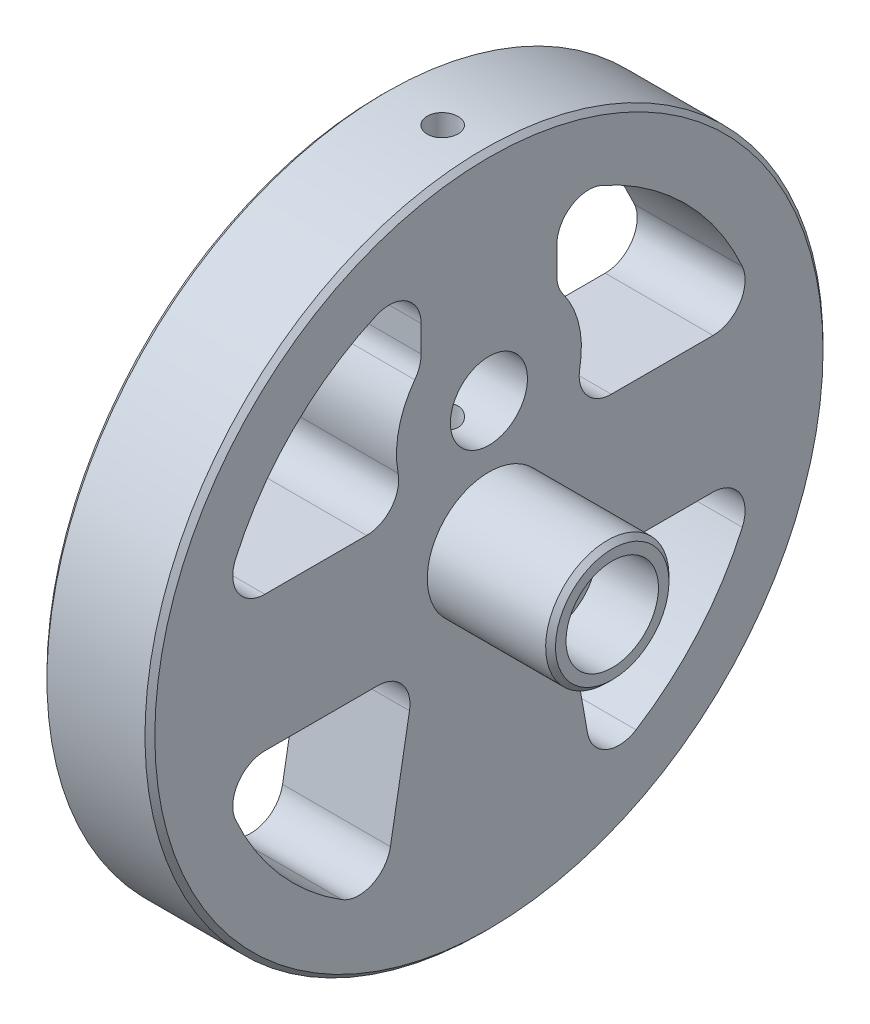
SolidWorks part; units mm, degrees
ref_plane "Front Plane" through (0, 0, 0) normal (0, 0, 1) x (1, 0, 0)
ref_plane "Top Plane" through (0, 0, 0) normal (0, 1, 0) x (1, 0, 0)
ref_plane "Right Plane" through (0, 0, 0) normal (1, 0, 0) x (0, 0, -1)
sketch "Sketch1" plane through (0, 0, 0) normal (0, 0, 1) x (1, 0, 0)
  line L0 (0, 0) -> (0, 34.925)
  line L1 (0, 34.925) -> (11.1125, 34.925)
  line L2 (11.1125, 34.925) -> (11.1125, 6.35)
  line L3 (11.1125, 6.35) -> (23.8125, 6.35)
  line L4 (23.8125, 6.35) -> (23.8125, 4.7625)
  line L5 (17.4625, 0) -> (0, 0)
  line L6 (0, 0) -> (17.4625, 0) construction
  line L7 (23.8125, 4.7625) -> (17.4625, 4.7625)
  line L8 (17.4625, 4.7625) -> (17.4625, 0)
  line L9 (0, 0) -> (95.1145, 0) construction
  dimension "D1" = 12.7
  dimension "D2" = 69.85
  dimension "D3" = 11.1125
  dimension "D4" = 12.7
  dimension "D5" = 6.35
  dimension "D6" = 9.525
revolve "Revolve1" add sketch "Sketch1" angle 360 about L6
sketch "Sketch2" plane through (0, 0, 0) normal (-1, 0, 0) x (0, 0, 1)
  circle A0 centre (0, 12.7) radius 3.9688
  dimension "D1" = 7.9375
  dimension "D2" = 12.7
extrude "Cut-Extrude1" cut sketch "Sketch2" against normal through all
sketch "Sketch3" plane through (0, 0, 0) normal (-1, 0, 0) x (0, 0, 1)
  line L0 (0, 0) -> (39.2788, 0) construction
  line L1 (0, 0) -> (0, -14.0788) construction
  line L2 (10.1487, -22.0012) -> (8.1843, -10.8604)
  line L3 (-6.985, 23.0847) -> (-6.985, 20.3622)
  line L4 (6.985, 20.3622) -> (6.985, 23.0847)
  line L5 (-8.1843, -10.8604) -> (-10.1487, -22.0012)
  line L6 (11.4361, -6.985) -> (23.0847, -6.985)
  line L7 (12.598, 6.985) -> (23.0847, 6.985)
  line L8 (-12.598, 6.985) -> (-23.0847, 6.985)
  line L9 (-11.4361, -6.985) -> (-23.0847, -6.985)
  arc A0 (15.1514, -24.2274) -> (26.1008, -11.631) centre (0, 0) ccw
  arc A1 (-7.6389, 18.3898) -> (-9.3549, 10.9082) centre (0, 12.7) ccw
  circle A2 centre (0, 12.7) radius 3.9688 construction
  arc A3 (-11.631, 26.1008) -> (-26.1008, 11.631) centre (0, 0) ccw
  arc A4 (9.3549, 10.9082) -> (7.6389, 18.3898) centre (0, 12.7) ccw
  arc A5 (6.985, 20.3622) -> (7.6389, 18.3898) centre (10.287, 20.3622) ccw
  arc A6 (-7.6389, 18.3898) -> (-6.985, 20.3622) centre (-10.287, 20.3622) ccw
  arc A7 (6.985, 23.0847) -> (11.631, 26.1008) centre (10.287, 23.0847) cw
  arc A8 (-6.985, 23.0847) -> (-11.631, 26.1008) centre (-10.287, 23.0847) ccw
  arc A9 (-9.3549, 10.9082) -> (-12.598, 6.985) centre (-12.598, 10.287) cw
  arc A10 (9.3549, 10.9082) -> (12.598, 6.985) centre (12.598, 10.287) ccw
  arc A11 (10.1487, -22.0012) -> (15.1514, -24.2274) centre (13.4006, -21.4278) ccw
  arc A12 (-10.1487, -22.0012) -> (-15.1514, -24.2274) centre (-13.4006, -21.4278) cw
  arc A13 (11.4361, -6.985) -> (8.1843, -10.8604) centre (11.4361, -10.287) ccw
  arc A14 (-11.4361, -6.985) -> (-8.1843, -10.8604) centre (-11.4361, -10.287) cw
  arc A15 (26.1008, 11.631) -> (11.631, 26.1008) centre (0, 0) ccw
  arc A16 (-26.1008, -11.631) -> (-15.1514, -24.2274) centre (0, 0) ccw
  arc A17 (23.0847, -6.985) -> (26.1008, -11.631) centre (23.0847, -10.287) cw
  arc A18 (23.0847, 6.985) -> (26.1008, 11.631) centre (23.0847, 10.287) ccw
  arc A19 (-23.0847, 6.985) -> (-26.1008, 11.631) centre (-23.0847, 10.287) cw
  arc A20 (-23.0847, -6.985) -> (-26.1008, -11.631) centre (-23.0847, -10.287) ccw
  point P17 (6.985, 19.1758)
  point P24 (-6.985, 27.7081)
  point P48 (27.7081, 6.985)
  point P53 (-27.7081, -6.985)
  dimension "D4" = 3.302
  dimension "D5" = 13.97
  dimension "D6" = 3.302
  dimension "D7" = 3.302
  dimension "D8" = 20
  dimension "D1" = 57.15
  dimension "D2" = 19.05
  dimension "D3" = 13.97
extrude "Cut-Extrude2" cut sketch "Sketch3" against normal through all
sketch "Sketch4" plane through (0, 0, 0) normal (0, 1, 0) x (1, 0, 0)
  circle A0 centre (6.35, 0) radius 1.5875
  dimension "D1" = 3.175
  dimension "D2" = 6.35
extrude "Cut-Extrude3" cut sketch "Sketch4" along normal through all
hole_wizard "1/4-28 Tapped Hole1" positions "Sketch6" profile "Sketch5" tap size "1/4-28" standard "Ansi Inch"
sketch "Sketch6" plane through (17.4625, 0, 0) normal (1, 0, 0) x (0, 0, -1)
  point P0 (0, 0)
sketch "Sketch5" plane through (17.4625, 0, 0) normal (0, 1, 0) x (0, 0, -1)
  line L0 (0, 0) -> (0, 17.0432)
  line L1 (0, 17.0432) -> (2.7051, 15.4178)
  line L2 (2.7051, 15.4178) -> (2.7051, 12.7)
  line L3 (2.7051, 12.7) -> (3.175, 12.7)
  line L4 (3.175, 12.7) -> (3.175, 0)
  line L5 (3.175, 0) -> (0, 0)
  line L10 (0, 17.0432) -> (-2.7051, 15.4178) construction
  line L11 (0, -6.35) -> (0, 107.95) construction
  dimension "Tap Drill Dia." = 5.4102
  dimension "Tap Drill Depth" = 15.4178
  dimension "Thread Major Dia." = 6.35
  dimension "Thread Depth" = 12.7
  dimension "Drill Angle" = 118
chamfer "Chamfer1" distance 0.508 angle 45 3 edges at (0, -34.925, 0) (11.1125, -34.925, 0) (23.8125, -6.35, 0)
